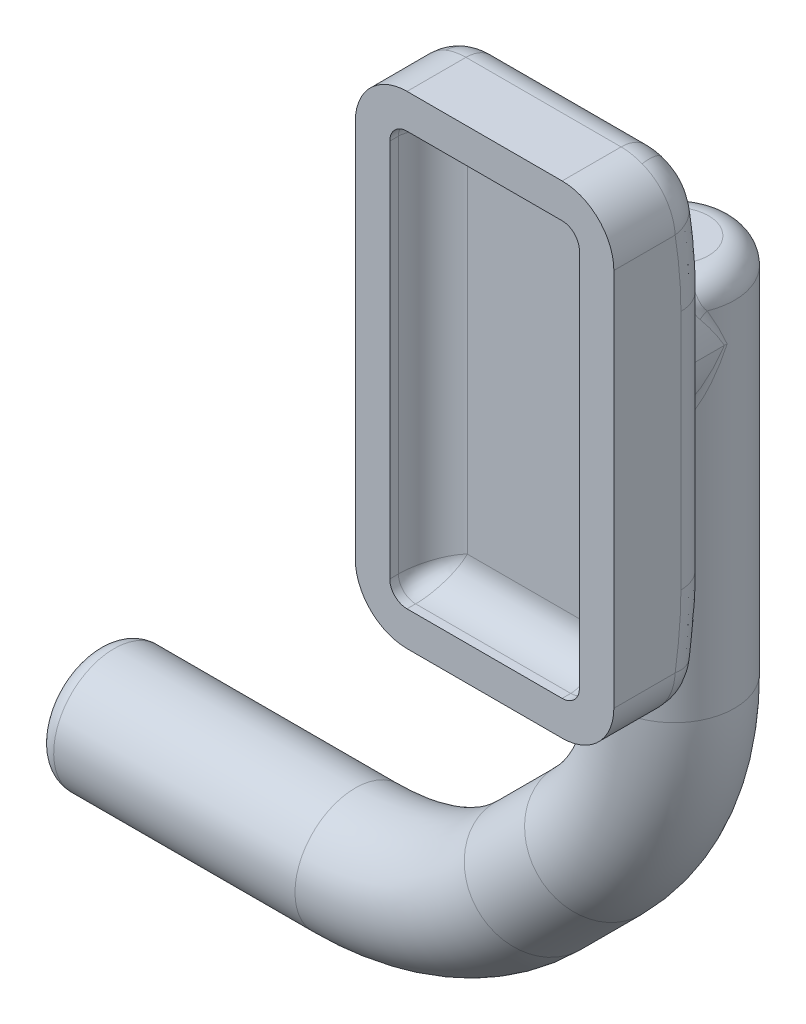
SolidWorks part; units mm, degrees
other "<Humvee ambulance - right mirror>-<Fillet8>"
ref_plane "Front Plane" through (0, 0, 0) normal (0, 0, 1) x (1, 0, 0)
ref_plane "Top Plane" through (0, 0, 0) normal (0, 1, 0) x (1, 0, 0)
ref_plane "Right Plane" through (0, 0, 0) normal (1, 0, 0) x (0, 0, -1)
mirrored part "Humvee ambulance - right mirror_Mirrored"
ref_plane "Plane2" through (0, -370, 0) normal (0, 1, 0) x (-1, 0, 0)
